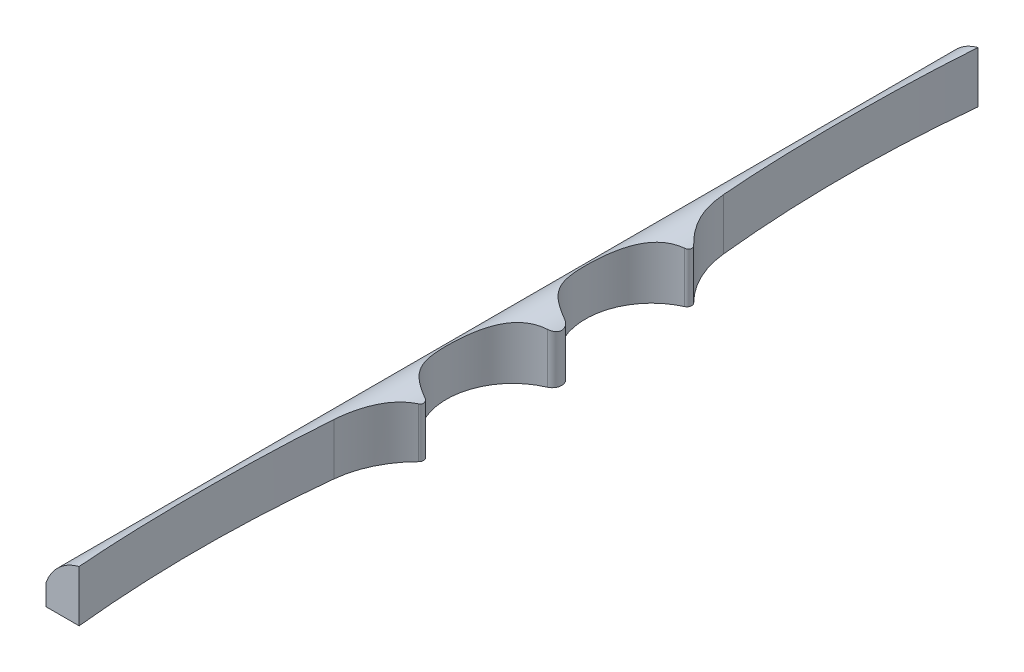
SolidWorks part; units mm, degrees
ref_plane "Alzado" through (0, 0, 0) normal (0, 0, 1) x (1, 0, 0)
ref_plane "Planta" through (0, 0, 0) normal (0, 1, 0) x (1, 0, 0)
ref_plane "Vista lateral" through (0, 0, 0) normal (1, 0, 0) x (0, 0, -1)
sketch "Croquis1" plane through (0, 0, 0) normal (0, 0, 1) x (1, 0, 0)
  line L0 (40, 35) -> (-40, -35) construction
  line L1 (-40, 35) -> (40, 35)
  line L2 (-40, 35) -> (-40, -35)
  line L3 (-40, -35) -> (40, -35)
  line L4 (40, 35) -> (40, -35)
extrude "Extruir1" add sketch "Croquis1" along normal mid plane 980
sketch "Croquis2" plane through (0, 35, 0) normal (0, 1, 0) x (1, 0, 0)
  line L0 (40, -490) -> (40, 490) construction
  line L1 (-40, 490) -> (40, 490)
  line L2 (-40, 490) -> (-40, 475)
  line L3 (-40, 475) -> (40, 475)
  line L4 (40, 490) -> (40, 475)
  line L6 (0, 0) -> (87.3084, 0) construction
  line L7 (40, -490) -> (40, -475)
  line L8 (-40, -475) -> (40, -475)
  line L9 (-40, -490) -> (-40, -475)
  line L10 (-40, -490) -> (40, -490)
  dimension "D1" = 15
extrude "Corte - largo" cut sketch "Croquis2" against normal through all
sketch "Croquis3" plane through (0, 35, 0) normal (0, 1, 0) x (1, 0, 0)
  line L0 (-5, 475) -> (40, 475)
  line L1 (0, 0) -> (116.1334, 0) construction
  line L2 (40, -475) -> (40, 475) construction
  line L3 (40, -475) -> (40, 475)
  line L4 (-5, -475) -> (40, -475)
  line L5 (-40, 475) -> (40, 475) construction
  line L6 (-40, -475) -> (-40, 475) construction
  arc A0 (-4.8432, 205.9311) -> (24.2223, 145.2939) centre (94.6157, 216.3205) ccw
  arc A1 (-4.8432, 205.9311) -> (-5, 475) centre (1290.307, 341.2206) cw
  arc A2 (20, 255) -> (-5, 225) centre (29.8148, 221.4043) ccw construction
  arc A3 (23.963, -9.1812) -> (23.963, 9.1812) centre (20, 0) ccw
  arc A4 (22.7694, 137.1897) -> (23.963, 9.1812) centre (51.7039, 73.4497) ccw
  arc A5 (22.7694, -137.1897) -> (23.963, -9.1812) centre (51.7039, -73.4497) cw
  arc A6 (-4.8432, -205.9311) -> (24.2223, -145.2939) centre (94.6157, -216.3205) cw
  arc A7 (22.7694, -137.1897) -> (24.2223, -145.2939) centre (20.7026, -141.7426) cw
  arc A8 (24.2223, 145.2939) -> (22.7694, 137.1897) centre (20.7026, 141.7426) cw
  arc A9 (20, 505) -> (-5, 475) centre (29.8148, 471.4043) ccw construction
  arc A10 (-4.8432, -205.9311) -> (-5, -475) centre (1290.307, -341.2206) ccw
  point P25 (30, -140)
  point P28 (30, 140)
  dimension "D1" = 140
  dimension "D2" = 10
  dimension "D4" = 60
  dimension "D5" = 70
  dimension "D6" = 5
  dimension "D7" = 100
  dimension "D3" = 70
extrude "Perfilado frontal" cut sketch "Croquis3" against normal through all
sketch "Croquis4" plane through (0, 0, -475) normal (0, 0, -1) x (-1, 0, 0)
  line L0 (40, -35) -> (40, 35) construction
  line L1 (40, -13) -> (40, 35)
  line L2 (40, 35) -> (5, 35) construction
  line L3 (40, 35) -> (-30, 35)
  line L4 (-30, 35) -> (-30, -35) construction
  line L5 (-30, 35) -> (-30, 15.4883)
  arc A0 (40, -13) -> (-50, -3) centre (-7.3426, -29.0835) ccw construction
  arc A1 (40, -13) -> (-30, 15.4883) centre (-7.3426, -29.0835) ccw
extrude "Perfilado lateral" cut sketch "Croquis4" against normal through all
